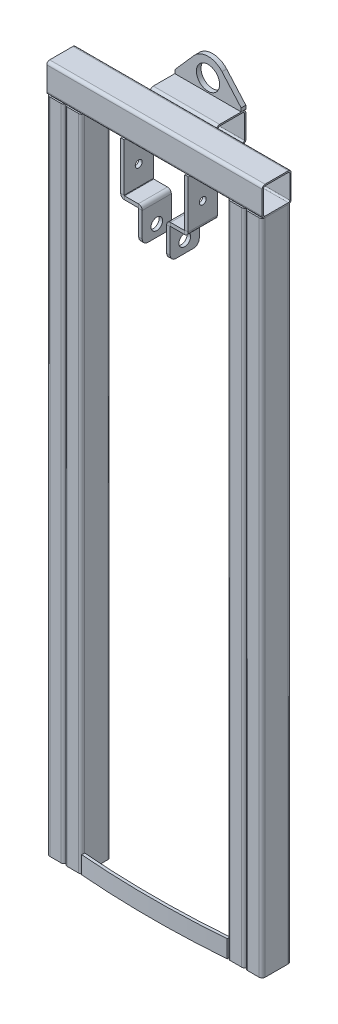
SolidWorks part; units mm, degrees
ref_plane "Plan de face" through (0, 0, 0) normal (0, 0, 1) x (1, 0, 0)
ref_plane "Plan de dessus" through (0, 0, 0) normal (0, 1, 0) x (1, 0, 0)
ref_plane "Plan de droite" through (0, 0, 0) normal (1, 0, 0) x (0, 0, -1)
sketch "Esquisse1" plane through (0, 0, 0) normal (0, 0, 1) x (1, 0, 0)
  line L0 (-185, 0) -> (185, 0)
  dimension "D1" = 370
other "Elément mécano-soudé1"
ref_plane "Plan1" through (-185, 0, 0) normal (1, 0, 0) x (0, 0, -1)
sketch "Sketch1" plane through (-185, 25, 0) normal (1, 0, 0) x (0, 0, -1)
  line L0 (-20, -22.5) -> (20, -22.5)
  line L1 (-22.5, -20) -> (-22.5, 20)
  line L2 (20, 22.5) -> (-20, 22.5)
  line L3 (22.5, 20) -> (22.5, -20)
  line L4 (-20, -25) -> (20, -25)
  line L5 (-25, -20) -> (-25, 20)
  line L6 (20, 25) -> (-20, 25)
  line L7 (25, 20) -> (25, -20)
  arc A0 (25, 20) -> (20, 25) centre (20, 20) ccw
  arc A1 (20, -25) -> (25, -20) centre (20, -20) ccw
  arc A2 (-25, -20) -> (-20, -25) centre (-20, -20) ccw
  arc A3 (-20, 25) -> (-25, 20) centre (-20, 20) ccw
  arc A4 (-20, 22.5) -> (-22.5, 20) centre (-20, 20) ccw
  arc A5 (22.5, 20) -> (20, 22.5) centre (20, 20) ccw
  arc A6 (20, -22.5) -> (22.5, -20) centre (20, -20) ccw
  arc A7 (-22.5, -20) -> (-20, -22.5) centre (-20, -20) ccw
  point P0 (-25, 0)
  point P1 (25, 0)
  point P2 (0, 25)
  point P3 (0, -25)
  point P4 (0, 0)
  point P5 (-25, -25)
  point P6 (25, -25)
  point P7 (25, 25)
  point P8 (-25, 25)
  point P33 (0, 0)
  dimension "D1" = 5
  dimension "Thickness" = 2.5
  dimension "V_leg" = 50
sketch "Esquisse3" plane through (0, 0, -25) normal (0, 0, -1) x (-1, 0, 0)
  line L0 (-57, 0) -> (57, 0)
  line L1 (185, 0) -> (-185, 0) construction
  dimension "D1" = 114
other "Elément mécano-soudé2"
ref_plane "Plan2" through (57, 0, -25) normal (-1, 0, 0) x (0, 0, 1)
sketch "Sketch11" plane through (57, 25, -50) normal (-1, 0, 0) x (0, 0, 1)
  line L0 (-20, -22.5) -> (20, -22.5)
  line L1 (-22.5, -20) -> (-22.5, 20)
  line L2 (20, 22.5) -> (-20, 22.5)
  line L3 (22.5, 20) -> (22.5, -20)
  line L4 (-20, -25) -> (20, -25)
  line L5 (-25, -20) -> (-25, 20)
  line L6 (20, 25) -> (-20, 25)
  line L7 (25, 20) -> (25, -20)
  arc A0 (25, 20) -> (20, 25) centre (20, 20) ccw
  arc A1 (20, -25) -> (25, -20) centre (20, -20) ccw
  arc A2 (-25, -20) -> (-20, -25) centre (-20, -20) ccw
  arc A3 (-20, 25) -> (-25, 20) centre (-20, 20) ccw
  arc A4 (-20, 22.5) -> (-22.5, 20) centre (-20, 20) ccw
  arc A5 (22.5, 20) -> (20, 22.5) centre (20, 20) ccw
  arc A6 (20, -22.5) -> (22.5, -20) centre (20, -20) ccw
  arc A7 (-22.5, -20) -> (-20, -22.5) centre (-20, -20) ccw
  point P0 (-25, 0)
  point P1 (25, 0)
  point P2 (0, 25)
  point P3 (0, -25)
  point P4 (0, 0)
  point P5 (-25, -25)
  point P6 (25, -25)
  point P7 (25, 25)
  point P8 (-25, 25)
  point P33 (0, 0)
  dimension "D1" = 5
  dimension "Thickness" = 2.5
  dimension "V_leg" = 50
inserted part "crochet de levage"
move or copy body "Corps-Déplacer/Copier2" placed by mates yes
other "<crochet de levage>-<Extrusion1>"
sketch "Esquisse5" plane through (0, 0, -25) normal (0, 0, -1) x (-1, 0, 0)
  line L0 (-185, 0) -> (-185, -1130)
  line L1 (-155, 0) -> (-155, -1130)
  line L2 (185, 0) -> (-185, 0) construction
  dimension "D1" = 1130
  dimension "D2" = 30
other "Elément mécano-soudé3"
ref_plane "Plan3" through (185, 0, -25) normal (0, -1, 0) x (1, 0, 0)
sketch "Sketch12" plane through (170, 0, 0) normal (0, -1, 0) x (1, 0, 0)
  line L0 (-9.8, -22.4) -> (9.8, -22.4)
  line L1 (-12.4, -19.8) -> (-12.4, 19.8)
  line L2 (9.8, 22.4) -> (-9.8, 22.4)
  line L3 (12.4, 19.8) -> (12.4, -19.8)
  line L4 (-9.8, -25) -> (9.8, -25)
  line L5 (-15, -19.8) -> (-15, 19.8)
  line L6 (9.8, 25) -> (-9.8, 25)
  line L7 (15, 19.8) -> (15, -19.8)
  arc A0 (15, 19.8) -> (9.8, 25) centre (9.8, 19.8) ccw
  arc A1 (9.8, -25) -> (15, -19.8) centre (9.8, -19.8) ccw
  arc A2 (-15, -19.8) -> (-9.8, -25) centre (-9.8, -19.8) ccw
  arc A3 (-9.8, 25) -> (-15, 19.8) centre (-9.8, 19.8) ccw
  arc A4 (-9.8, 22.4) -> (-12.4, 19.8) centre (-9.8, 19.8) ccw
  arc A5 (12.4, 19.8) -> (9.8, 22.4) centre (9.8, 19.8) ccw
  arc A6 (9.8, -22.4) -> (12.4, -19.8) centre (9.8, -19.8) ccw
  arc A7 (-12.4, -19.8) -> (-9.8, -22.4) centre (-9.8, -19.8) ccw
  point P0 (0, 25)
  point P1 (15, 0)
  point P2 (0, -25)
  point P3 (-15, 0)
  point P4 (-15, 25)
  point P5 (15, 25)
  point P6 (15, -25)
  point P7 (-15, -25)
  point P8 (0, 0)
  point P33 (0, 0)
  dimension "D1" = 5.2
  dimension "Thickness" = 2.6
  dimension "V_leg" = 50
  dimension "H_leg" = 30
mirror "Symétrie1" about plane through (0, 0, 0) normal (1, 0, 0)
sketch "Esquisse8" plane through (0, -1130, 0) normal (0, -1, 0) x (1, 0, 0)
  line L0 (185, 25) -> (-185, 25) construction
  line L1 (125, 19.8) -> (125, -19.8) construction
  line L2 (-125, 19.8) -> (-125, -19.8) construction
  arc A0 (-125, 25) -> (125, 25) centre (0, -1535) cw
  dimension "D1" = 5
other "Elément mécano-soudé4"
ref_plane "Plan5" through (-125, -1130, 25) normal (0.9968, 0, 0.0799) x (0.0799, 0, -0.9968)
sketch "Esquisse11" plane through (-124.8003, -1115, 22.508) normal (0.9968, 0, 0.0799) x (0, -1, 0)
  line L0 (0, 2.5) -> (0, -2.5) construction
  line L1 (-15, 2.5) -> (15, 2.5)
  line L2 (-15, 2.5) -> (-15, -2.5)
  line L3 (-15, -2.5) -> (15, -2.5)
  line L4 (15, 2.5) -> (15, -2.5)
  line L5 (-15, 0) -> (15, 0) construction
  point P8 (0, 0)
  dimension "D1" = 30
  dimension "D2" = 5
inserted part "laser chape vérin de levée"
move or copy body "Corps-Déplacer/Copier4" placed by mates yes
other "Distance1" parameters "D1"=52
other "<laser chape vérin de levée>-<Diamètre du perçage Ø20.0 (20)1>"
inserted part "laser chape vérin de levée1"
move or copy body "Corps-Déplacer/Copier6" placed by mates yes
other "Distance2" parameters "D1"=52
other "<laser chape vérin de levée>-<Diamètre du perçage Ø20.0 (20)1>"
